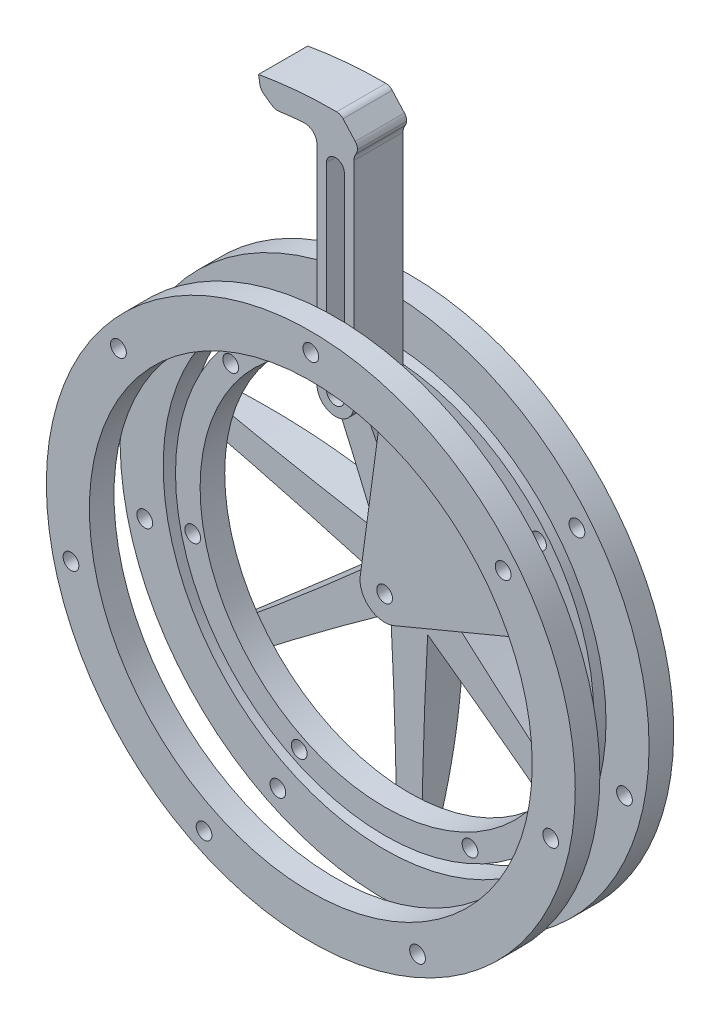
SolidWorks part; units mm, degrees
ref_plane "Front Plane" through (0, 0, 0) normal (0, 0, 1) x (1, 0, 0)
ref_plane "Top Plane" through (0, 0, 0) normal (0, 1, 0) x (1, 0, 0)
ref_plane "Right Plane" through (0, 0, 0) normal (1, 0, 0) x (0, 0, -1)
sketch "Sketch1" plane through (0, 0, 0) normal (0, 0, 1) x (1, 0, 0)
  line L0 (0, 63.5) -> (-20.7038, 83.2019) construction
  line L1 (0, 63.5) -> (16.0966, 48.1823) construction
  line L2 (0, 0) -> (16.0966, 48.1823) construction
  line L3 (-46.096, 82.5722) -> (-20.7038, 83.2019)
  line L9 (0, 0) -> (47.7066, 17.4563) construction
  line L10 (49.6463, 39.5916) -> (47.7066, 17.4563) construction
  line L11 (49.6463, 39.5916) -> (52.1412, 68.0624) construction
  line L12 (35.8172, 87.5222) -> (52.1412, 68.0624)
  line L13 (0, 0) -> (43.3925, -26.4146) construction
  line L14 (61.9079, -14.1301) -> (43.3925, -26.4146) construction
  line L15 (61.9079, -14.1301) -> (85.7229, 1.6706) construction
  line L16 (90.7593, 26.5662) -> (85.7229, 1.6706)
  line L17 (0, 0) -> (6.403, -50.3949) construction
  line L18 (27.5516, -57.2115) -> (6.403, -50.3949) construction
  line L19 (27.5516, -57.2115) -> (54.7534, -65.9793) construction
  line L20 (77.3578, -54.3947) -> (54.7534, -65.9793)
  line L21 (0, 0) -> (-35.4081, -36.4267) construction
  line L22 (-27.5516, -57.2115) -> (-35.4081, -36.4267) construction
  line L23 (-27.5516, -57.2115) -> (-17.4465, -83.9453) construction
  line L24 (5.7043, -94.3953) -> (-17.4465, -83.9453)
  line L25 (0, 0) -> (-50.5562, 4.9715) construction
  line L26 (-61.9079, -14.1301) -> (-50.5562, 4.9715) construction
  line L27 (-61.9079, -14.1301) -> (-76.5088, -38.6989) construction
  line L28 (-70.2446, -63.3143) -> (-76.5088, -38.6989)
  line L29 (0, 0) -> (-27.6344, 42.6261) construction
  line L30 (-49.6463, 39.5916) -> (-27.6344, 42.6261) construction
  line L31 (-49.6463, 39.5916) -> (-77.9585, 35.6886) construction
  line L32 (-93.298, 15.4436) -> (-77.9585, 35.6886)
  circle A0 centre (0, 0) radius 63.5 construction
  circle A1 centre (0, 0) radius 50.8 construction
  point P34 (0, 0)
  point P42 (0, 0)
  dimension "D1" = 127
  dimension "D4" = 7
  dimension "D2" = 50.8
  dimension "D3" = 50.8
  dimension "D5" = 94.5675
  dimension "D6" = 135
  dimension "D7" = 25.4
sketch "Sketch2" plane through (0, 0, 0) normal (0, 0, 1) x (1, 0, 0)
  line L0 (0, 47.625) -> (0, 53.975) construction
  line L2 (0, 47.625) -> (-6.2933, 0.8467)
  line L3 (2.4466, -5.8597) -> (46.0022, 12.3263)
  circle A0 centre (0, 0) radius 53.975
  circle A1 centre (0, 0) radius 47.625
  circle A2 centre (0, 0) radius 50.8 construction
  circle A3 centre (0, 0) radius 68.2625
  circle A4 centre (0, 0) radius 57.15
  circle A5 centre (0, 0) radius 63.5 construction
  circle A6 centre (0, 50.8) radius 2.032
  circle A7 centre (0, 63.5) radius 2.032
  circle A8 centre (49.6463, 39.5916) radius 2.032
  circle A9 centre (39.717, 31.6733) radius 2.032
  circle A10 centre (61.9079, -14.1301) radius 2.032
  circle A11 centre (49.5263, -11.3041) radius 2.032
  circle A12 centre (27.5516, -57.2115) radius 2.032
  circle A13 centre (22.0413, -45.7692) radius 2.032
  circle A14 centre (-27.5516, -57.2115) radius 2.032
  circle A15 centre (-22.0413, -45.7692) radius 2.032
  circle A16 centre (-61.9079, -14.1301) radius 2.032
  circle A17 centre (-49.5263, -11.3041) radius 2.032
  circle A18 centre (-49.6463, 39.5916) radius 2.032
  circle A19 centre (-39.717, 31.6733) radius 2.032
  circle A20 centre (0, 0) radius 2.032
  arc A21 (-6.2933, 0.8467) -> (2.4466, -5.8597) centre (0, 0) ccw
  point P8 (16.0966, 48.1823)
  point P46 (0, 0)
  point P50 (0, 50.8)
  dimension "D2" = 4.7625
  dimension "D3" = 6.35
  dimension "D4" = 4.064
  dimension "D6" = 4.064
  dimension "D7" = 6.35
  dimension "D1" = 6.35
  dimension "D8" = 75
  dimension "D5" = 7
extrude "Boss-Extrude1" add sketch "Sketch2" along normal mid plane 6.35
sketch "Sketch3" plane through (0, 0, 3.175) normal (0, 0, 1) x (1, 0, 0)
  line L0 (0, 50.8) -> (0, 101.6) construction
  line L1 (-4.7625, 50.8) -> (-4.7625, 107.8449)
  line L2 (4.7625, 50.8) -> (4.7625, 107.8449)
  line L3 (0, 63.5) -> (0, 101.6) construction
  line L4 (-2.3114, 63.5) -> (-2.3114, 101.6)
  line L5 (2.3114, 63.5) -> (2.3114, 101.6)
  line L6 (-19.848, 112.5635) -> (0, 0) construction
  line L7 (0, 0) -> (5.982, 114.1434) construction
  line L9 (-19.848, 112.5635) -> (-18.7453, 106.31)
  line L11 (5.982, 114.1434) -> (5.6497, 107.8021)
  line L12 (-4.7625, 107.8449) -> (-4.7625, 114.2007) construction
  line L13 (4.7625, 107.8449) -> (4.7625, 114.2007) construction
  arc A0 (-4.7625, 50.8) -> (4.7625, 50.8) centre (0, 50.8) ccw
  arc A2 (-2.3114, 63.5) -> (2.3114, 63.5) centre (0, 63.5) ccw
  arc A3 (2.3114, 101.6) -> (-2.3114, 101.6) centre (0, 101.6) ccw
  circle A4 centre (0, 50.8) radius 2.3114
  arc A5 (-4.7625, 114.2007) -> (4.7625, 114.2007) centre (0, 0) cw
  arc A6 (-4.7625, 114.2007) -> (-19.848, 112.5635) centre (0, 0) ccw
  arc A7 (4.7625, 114.2007) -> (5.982, 114.1434) centre (0, 0) cw
  arc A8 (-18.7453, 106.31) -> (-4.7625, 107.8449) centre (0, 0) cw
  arc A9 (-4.7625, 107.8449) -> (4.7625, 107.8449) centre (0, 0) cw construction
  arc A10 (4.7625, 107.8449) -> (5.6497, 107.8021) centre (0, 0) cw
  point P10 (0, 82.55)
  dimension "D2" = 2.3114
  dimension "D7" = 4.6228
  dimension "D4" = 114.3
  dimension "D1" = 9.525
  dimension "D3" = 50.8
  dimension "D5" = 6.35
  dimension "D6" = 10
  dimension "D8" = 3
extrude "Boss-Extrude2" add sketch "Sketch3" along normal blind 12.7 separate body
pattern_linear "LPattern1" count 2 spacing 19.05 along (0, 0, 1)
sketch "Sketch5" plane through (0, 0, -3.175) normal (0, 0, -1) x (-1, 0, 0)
  line L0 (-49.6463, 39.5916) -> (0, 63.5) construction
  line L1 (-24.8231, 51.5458) -> (0, 0) construction
  line L2 (-32.4465, 60.0582) -> (-26.7254, 62.8134) construction
  line L3 (-8.5817, 6.8437) -> (0, 10.9764) construction
  line L4 (0, 10.9764) -> (0, 0) construction
  line L5 (-26.7254, 62.8134) -> (-1.4303, 10.2877) construction
  arc A0 (-32.4465, 60.0582) -> (-26.7254, 62.8134) centre (0, 0) cw
  circle A1 centre (0, 0) radius 68.2625 construction
  arc A2 (-26.7254, 62.8134) -> (0, 10.9764) centre (938.465, 527.6246) ccw
  arc A3 (-32.4465, 60.0582) -> (-8.5817, 6.8437) centre (-997.6369, -404.753) cw
  arc A4 (26.7254, 62.8134) -> (32.4465, 60.0582) centre (0, 0) cw
  arc A5 (26.7254, 62.8134) -> (0, 10.9764) centre (-938.465, 527.6246) cw
  arc A6 (32.4465, 60.0582) -> (8.5817, 6.8437) centre (997.6369, -404.753) ccw
  arc A7 (65.7725, 18.2688) -> (67.1855, 12.078) centre (0, 0) cw
  arc A8 (65.7725, 18.2688) -> (8.5817, 6.8437) centre (-172.6099, 1062.6901) cw
  arc A9 (67.1855, 12.078) -> (10.7012, -2.4425) centre (305.5678, -1032.3433) ccw
  arc A10 (55.2916, -40.0326) -> (51.3324, -44.9972) centre (0, 0) cw
  arc A11 (55.2916, -40.0326) -> (10.7012, -2.4425) centre (723.2241, 797.5282) cw
  arc A12 (51.3324, -44.9972) -> (4.7625, -9.8894) centre (-616.6001, -882.5581) ccw
  arc A13 (3.175, -68.1886) -> (-3.175, -68.1886) centre (0, 0) cw
  arc A14 (3.175, -68.1886) -> (4.7625, -9.8894) centre (1074.4555, -68.1886) cw
  arc A15 (-3.175, -68.1886) -> (-4.7625, -9.8894) centre (-1074.4555, -68.1886) ccw
  arc A16 (-51.3324, -44.9972) -> (-55.2916, -40.0326) centre (0, 0) cw
  arc A17 (-51.3324, -44.9972) -> (-4.7625, -9.8894) centre (616.6001, -882.5581) cw
  arc A18 (-55.2916, -40.0326) -> (-10.7012, -2.4425) centre (-723.2241, 797.5282) ccw
  arc A19 (-67.1855, 12.078) -> (-65.7725, 18.2688) centre (0, 0) cw
  arc A20 (-67.1855, 12.078) -> (-10.7012, -2.4425) centre (-305.5678, -1032.3433) cw
  arc A21 (-65.7725, 18.2688) -> (-8.5817, 6.8437) centre (172.6099, 1062.6901) ccw
  circle A22 centre (0, 0) radius 2.159
  point P11 (-29.618, 61.5024)
  point P17 (-4.2909, 8.9101)
  point P57 (0, 0)
  dimension "D4" = 4.318
  dimension "D1" = 6.35
  dimension "D2" = 9.525
  dimension "D3" = 7
extrude "Boss-Extrude3" add sketch "Sketch5" along normal blind 9.525 contours A21 A20 A18 A17 A15 A14 A12 A11 A9 A8 A6 A5 A2 A3 A22 M34 | A21 A20 M35 M34 | A3 A2 M35 M34 | A6 A5 M35 M34 | A9 A8 M35 M34 | A12 A11 M35 M34 | A15 A14 M35 M34 | A18 A17 M35 M34
sketch "Sketch6" plane through (0, 0, 0) normal (0, 1, 0) x (1, 0, 0)
  line L0 (0, 12.7) -> (-26.7254, 12.7) construction
  line L1 (-68.2625, 3.175) -> (-68.2625, 12.7)
  line L2 (-68.2625, 12.7) -> (-20.0067, 12.7)
  line L3 (0, 0) -> (0, 12.8521) construction
  arc A0 (-68.2625, 3.175) -> (-20.0067, 12.7) centre (-20.0067, -114.3) cw
  dimension "D1" = 127
revolve "Cut-Revolve1" cut sketch "Sketch6" angle 360 about L3
fillet "Fillet1" radius 3.175 14 edges at (-46.9724, -41.5387, -3.175) (-50.9496, -36.5515, -3.175) (-3.1895, -62.6235, -3.175) (3.1895, -62.6235, -3.175) (50.9496, -36.5515, -3.175) (46.9724, -41.5387, -3.175) (61.7631, 10.8255, -3.175) (60.3437, 17.0445, -3.175) (24.2977, 57.8057, -3.175) (30.0449, 55.038, -3.175) (-24.2977, 57.8057, -3.175) (-30.0449, 55.038, -3.175) (-61.7631, 10.8255, -3.175) (-60.3437, 17.0445, -3.175)
fillet "Fillet2" radius 3.175 2 edges at (4.7625, 107.8449, 9.525) (-4.7625, 107.8449, 9.525)
chamfer "Chamfer1" distance 3.175 angle 45 1 edges at (-18.7453, 106.31, 9.525)
chamfer "Chamfer2" distance 4.7625 angle 45 1 edges at (5.982, 114.1434, 9.525)
fillet "Fillet3" radius 2.2225 5 edges at (-15.5628, 106.8223, 9.525) (-19.2967, 109.4368, 9.525) (5.6497, 107.8021, 9.525) (1.3162, 114.2924, 9.525) (5.7327, 109.3874, 9.525)
